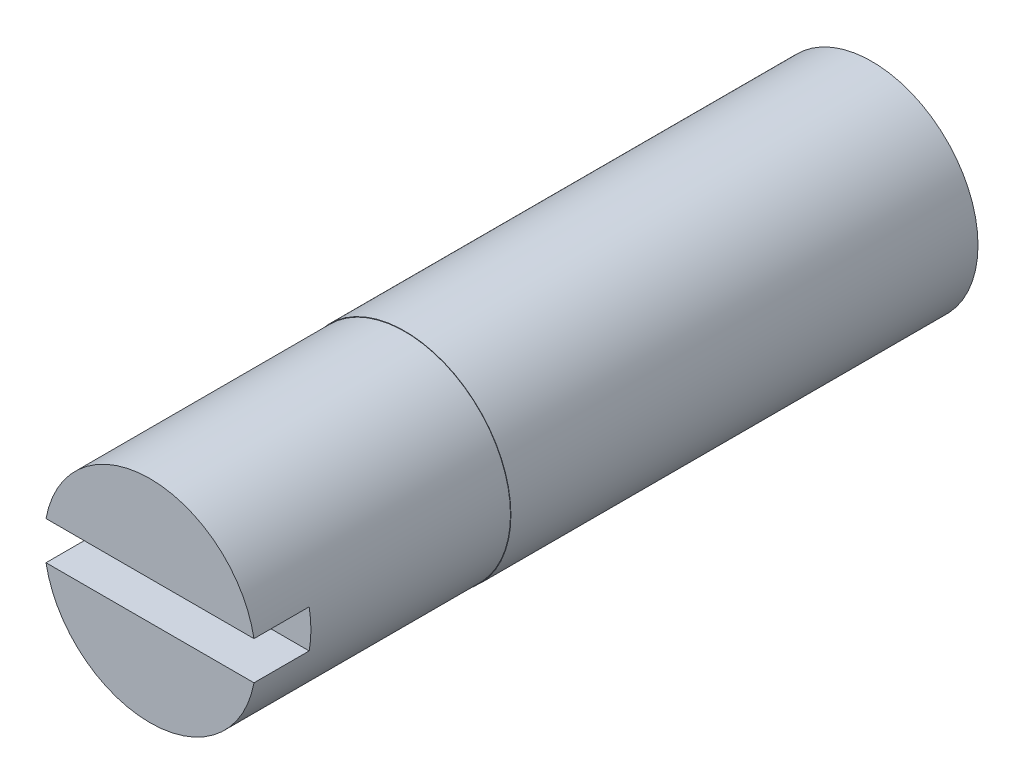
SolidWorks part; units mm, degrees
other "標示1"
sketch "草圖14" plane through (-2.5, 2.5, 3.5) normal (-0.7678, 0.631, 0.1112) x (-0.6334, -0.7736, 0.0168)
other "標示2"
sketch "草圖15" plane through (-2.5, -2.5, 3) normal (-0.8992, -0.1971, 0.3907) x (0.3045, -0.923, 0.2352)
other "標示3"
sketch "草圖16" plane through (-2.5, -2.5, -11) normal (-0.6524, -0.7559, -0.0546) x (0.7385, -0.6503, 0.1783)
ref_plane "前基準面" through (0, 0, 0) normal (0, 0, 1) x (1, 0, 0)
ref_plane "上基準面" through (0, 0, 0) normal (0, 1, 0) x (1, 0, 0)
ref_plane "右基準面" through (0, 0, 0) normal (1, 0, 0) x (0, 0, -1)
sketch "草圖1" plane through (0, 0, 0) normal (0, 0, 1) x (1, 0, 0)
  circle A0 centre (0, 0) radius 2.49
  dimension "D1" = 4.98
extrude "填料-伸長1" add sketch "草圖1" along normal blind 6
sketch "草圖8" plane through (0, 0, 6) normal (0, 0, 1) x (1, 0, 0)
  line L0 (0, 0) -> (2.5, 0)
  line L1 (2.5, -0.45) -> (2.5, 0.45)
  line L6 (-2.5, -0.45) -> (2.5, -0.45)
  line L7 (2.5, 0.45) -> (-2.5, 0.45)
  line L8 (0, 2.49) -> (0, -2.49)
  line L9 (-2.5, -0.45) -> (-2.5, 0.45)
  circle A0 centre (0, 0) radius 2.49 construction
  point P13 (0, -0.45)
  point P14 (0, 0.45)
  dimension "D1" = 0.45
  dimension "D2" = 2.5
extrude "除料-伸長2" cut sketch "草圖8" against normal blind 1.3
sketch "草圖9" plane through (0, 0, 0) normal (0, 0, -1) x (-1, 0, 0)
  circle A0 centre (0, 0) radius 2.5
  dimension "D1" = 5
extrude "填料-伸長2" add sketch "草圖9" along normal blind 11
